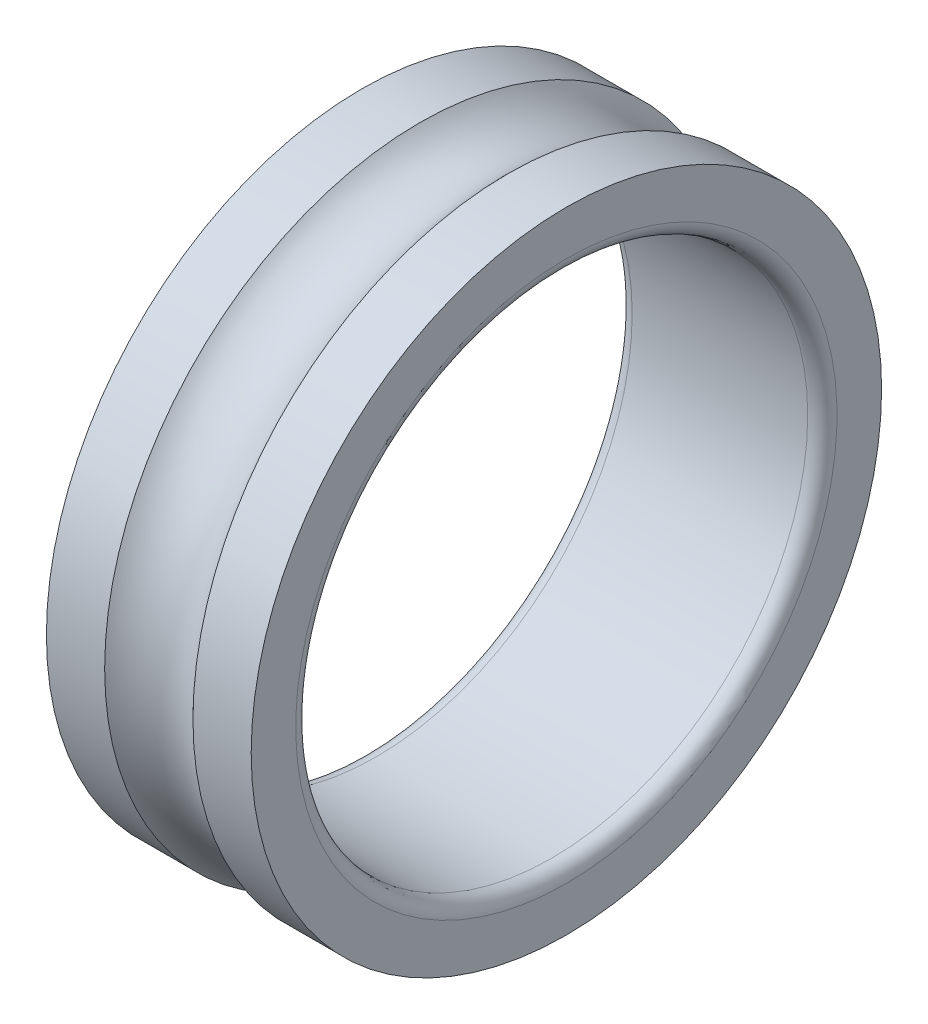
SolidWorks part; units mm, degrees
ref_plane "Plan de face" through (0, 0, 0) normal (0, 0, 1) x (1, 0, 0)
ref_plane "Plan de dessus" through (0, 0, 0) normal (0, 1, 0) x (1, 0, 0)
ref_plane "Plan de droite" through (0, 0, 0) normal (1, 0, 0) x (0, 0, -1)
sketch "Esquisse1" plane through (0, 0, 0) normal (0, 0, 1) x (1, 0, 0)
  line L0 (7, 31) -> (7, 17.5) construction
  line L1 (1, 31) -> (13, 31) construction
  line L2 (0, 30) -> (0, 18.5) construction
  line L3 (1, 17.5) -> (13, 17.5)
  line L4 (14, 30) -> (14, 18.5) construction
  line L5 (14, 26.95) -> (0, 26.95) construction
  line L6 (14, 21.55) -> (10.0187, 21.55)
  line L7 (0, 0) -> (14, 0) construction
  line L8 (14, 21.55) -> (14, 18.5)
  line L9 (0, 21.55) -> (0, 18.5)
  line L10 (3.9813, 21.55) -> (0, 21.55)
  arc A1 (0, 18.5) -> (1, 17.5) centre (1, 18.5) ccw
  arc A2 (1, 31) -> (0, 30) centre (1, 30) ccw construction
  arc A3 (14, 30) -> (13, 31) centre (13, 30) ccw construction
  arc A4 (13, 17.5) -> (14, 18.5) centre (13, 18.5) ccw
  arc A5 (3.9813, 21.55) -> (10.0187, 21.55) centre (7, 24.25) ccw
  dimension "D4" = 1
  dimension "D5" = 8.1
  dimension "D1" = 17.5
  dimension "D2" = 31
  dimension "D3" = 14
  dimension "D6" = 21.55
  dimension "D7" = 26.95
revolve "Révolution1" add sketch "Esquisse1" angle 360 about L7
